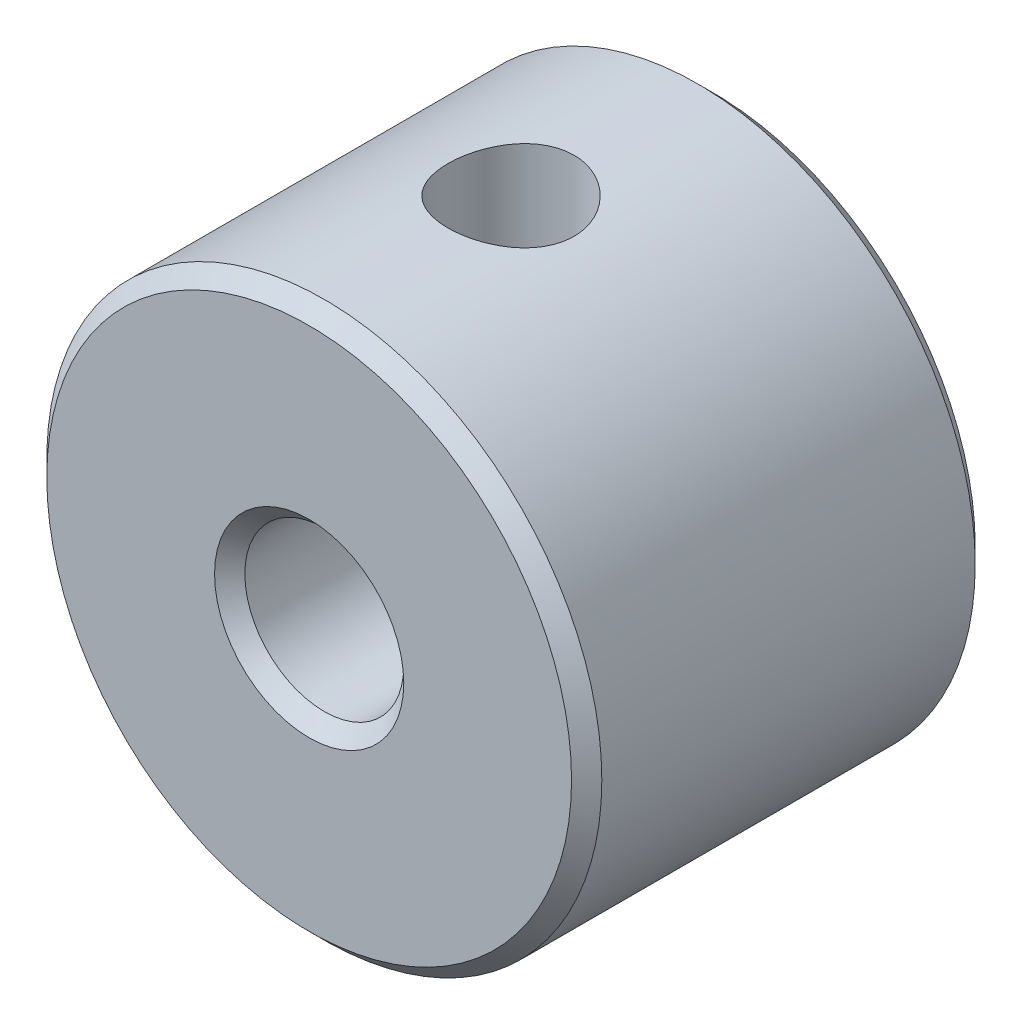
SolidWorks part; units mm, degrees
ref_plane "Plan de face" through (0, 0, 0) normal (0, 0, 1) x (1, 0, 0)
ref_plane "Plan de dessus" through (0, 0, 0) normal (0, 1, 0) x (1, 0, 0)
ref_plane "Plan de droite" through (0, 0, 0) normal (1, 0, 0) x (0, 0, -1)
sketch "Esquisse1" plane through (0, 0, 0) normal (0, 0, 1) x (1, 0, 0)
  circle A0 centre (0, 0) radius 5.5
  circle A1 centre (0, 0) radius 1.575
extrude "Boss.-Extru.1" add sketch "Esquisse1" along normal blind 8
ref_plane "Plan1" through (0, 0, 0) normal (0, 1, 0) x (-1, 0, 0)
sketch "Esquisse2" plane through (0, 0, 0) normal (0, 1, 0) x (-1, 0, 0)
  line L0 (0, 5.42) -> (0, -1.9043) construction
  line L1 (-8.0344, 4) -> (2.8326, 4) construction
  circle A0 centre (0, 4) radius 1.25
extrude "Enlèv. mat.-Extru.1" cut sketch "Esquisse2" along normal blind 8
chamfer "Chanfrein1" distance 0.3 angle 45 4 edges at (1.575, 0, 0) (5.5, 0, 0) (1.575, 0, 8) (5.5, 0, 8)
